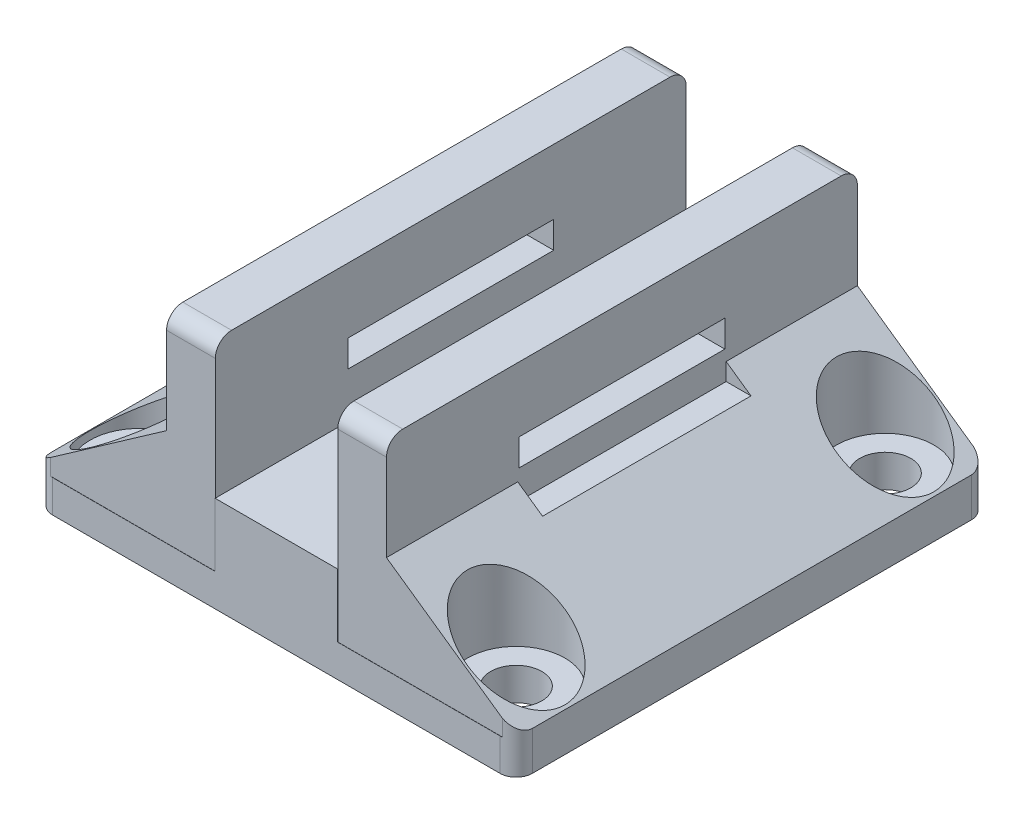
SolidWorks part; units mm, degrees
ref_plane "Front Plane" through (0, 0, 0) normal (0, 0, 1) x (1, 0, 0)
ref_plane "Top Plane" through (0, 0, 0) normal (0, 1, 0) x (1, 0, 0)
ref_plane "Right Plane" through (0, 0, 0) normal (1, 0, 0) x (0, 0, -1)
sketch "Sketch3" plane through (0, 0, 0) normal (1, 0, 0) x (0, 0, -1)
  line L0 (-18.415, 0) -> (18.415, 0)
  line L1 (-18.415, 0) -> (-18.415, 18.229)
  line L2 (-18.415, 18.229) -> (18.415, 18.229)
  line L3 (18.415, 18.229) -> (18.415, 0)
  line L4 (-8.05, 11.049) -> (8.05, 11.049)
  line L5 (-8.05, 11.049) -> (-8.05, 13.149)
  line L6 (-8.05, 13.149) -> (8.05, 13.149)
  line L7 (8.05, 13.149) -> (8.05, 11.049)
  point P4 (0, 0)
  point P10 (0, 11.049)
  dimension "D1" = 36.83
  dimension "D2" = 11.049
  dimension "D3" = 2.1
  dimension "D4" = 5.08
  dimension "D5" = 16.1
extrude "Boss-Extrude1" add sketch "Sketch3" along normal blind 3.81
ref_plane "Plane1" through (-4.7879, 0, 0) normal (-1, 0, 0) x (0, 0, 1)
sketch "Sketch4" plane through (0, 0, 0) normal (0, 1, 0) x (1, 0, 0)
  line L0 (3.81, -18.415) -> (3.81, 18.415) construction
  line L1 (13.97, 18.43) -> (-23.5458, 18.43)
  line L2 (13.97, 18.43) -> (13.97, -18.43)
  line L4 (-23.5458, 18.43) -> (-23.5458, -18.43)
  line L5 (-4.7879, 5.8674) -> (-4.7879, -5.8674) construction
  line L6 (-23.5458, -18.43) -> (13.97, -18.43)
  point P10 (-4.7879, -18.43)
  dimension "D1" = 10.16
  dimension "D2" = 18.43
  dimension "D3" = 18.43
extrude "Boss-Extrude2" add sketch "Sketch4" along normal blind 2.54
mirror "Mirror2" about plane through (-4.7879, 0, 0) normal (-1, 0, 0) of "Boss-Extrude1"
sketch "Sketch7" plane through (0, 0, 0) normal (0, -1, 0) x (1, 0, 0)
  line L0 (13.97, 0) -> (-23.5458, 0) construction
  line L1 (13.97, 18.43) -> (13.97, -18.43) construction
  line L2 (-23.5458, -18.43) -> (-23.5458, 18.43) construction
  line L3 (-23.5458, 18.43) -> (13.97, 18.43) construction
  line L4 (13.97, 18.43) -> (13.97, -18.43) construction
  circle A0 centre (9.97, 14.43) radius 2
  dimension "D1" = 4
  dimension "D2" = 4
  dimension "D3" = 4
extrude "Cut-Extrude1" cut sketch "Sketch7" against normal up to next
mirror "Mirror3" about plane through (0, 0, 0) normal (0, 0, 1) of "Cut-Extrude1"
fillet "Fillet2" radius 1.27 4 edges at (13.97, 1.27, 18.43) (-23.5458, 1.27, 18.43) (-23.5458, 1.27, -18.43) (13.97, 1.27, -18.43)
fillet "Fillet3" radius 1.27 4 edges at (1.905, 18.229, -18.415) (1.905, 18.229, 18.415) (-11.4808, 18.229, 18.415) (-11.4808, 18.229, -18.415)
sketch "Sketch8" plane through (0, 0, 0) normal (0, -1, 0) x (1, 0, 0)
  line L0 (13.97, 0) -> (-23.5458, 0) construction
  line L1 (13.97, 17.16) -> (13.97, -17.16) construction
  line L2 (-23.5458, -17.16) -> (-23.5458, 17.16) construction
sketch "Sketch10" plane through (0, 2.54, 0) normal (0, 1, 0) x (1, 0, 0)
  circle A0 centre (9.97, 14.43) radius 3.81
  dimension "D1" = 7.62
sketch "Sketch13" plane through (0, 0, -18.43) normal (0, 0, -1) x (-1, 0, 0)
  line L0 (9.5758, 2.54) -> (9.5758, 16.959) construction
  line L1 (0, 2.54) -> (9.5758, 2.54)
  line L2 (0, 2.54) -> (0, 7.493)
  line L3 (0, 7.493) -> (9.5758, 7.493)
  line L4 (9.5758, 2.54) -> (9.5758, 7.493)
  dimension "D1" = 3.556
extrude "Boss-Extrude4" add sketch "Sketch13" against normal up to surface (36.86 mm away)
chamfer "Chamfer1" distance 7.62 angle 55 2 edges at (-13.3858, 2.54, 0) (3.81, 2.54, 0)
extrude "Cut-Extrude2" cut sketch "Sketch10" along normal up to next
mirror "Mirror4" about plane through (0, 0, 0) normal (0, 0, 1) of "Cut-Extrude2"
ref_plane "Plane2" through (0, 8.8, 0) normal (0, -1, 0) x (-1, 0, 0)
sketch "Sketch14" plane through (0, 8.8, 0) normal (0, -1, 0) x (-1, 0, 0)
  line L0 (-13.97, 0) -> (23.5458, 0) construction
  line L1 (-3.81, -8.15) -> (-5.8888, -8.15)
  line L2 (-3.81, -8.15) -> (-3.81, 8.15)
  line L3 (-3.81, 8.15) -> (-5.8888, 8.15)
  line L4 (-5.8888, -8.15) -> (-5.8888, 8.15)
  line L5 (-3.81, -8.15) -> (-5.8888, 8.15) construction
  line L6 (-3.81, 8.15) -> (-5.8888, -8.15) construction
  line L7 (-3.81, -18.415) -> (-3.81, 18.415) construction
  point P0 (-4.8494, 0)
  dimension "D1" = 16.3
extrude "Cut-Extrude3" cut sketch "Sketch14" against normal through all
mirror "Mirror5" about plane through (-4.7879, 0, 0) normal (-1, 0, 0) of "Cut-Extrude3"
